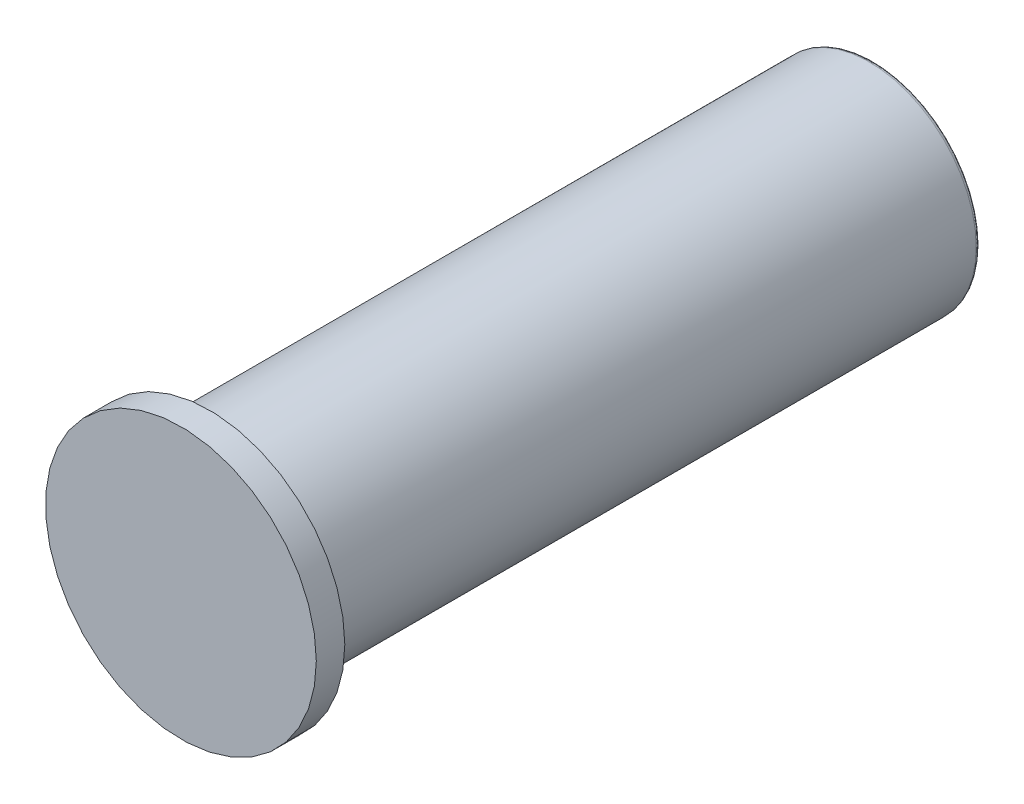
SolidWorks part; units mm, degrees
ref_plane "Front Plane" through (0, 0, 0) normal (0, 0, 1) x (1, 0, 0)
ref_plane "Top Plane" through (0, 0, 0) normal (0, 1, 0) x (1, 0, 0)
ref_plane "Right Plane" through (0, 0, 0) normal (1, 0, 0) x (0, 0, -1)
sketch "Sketch1" plane through (0, 0, 0) normal (1, 0, 0) x (0, 0, -1)
  line L0 (0, 0) -> (208, 0) construction
  line L1 (208, 0) -> (208, 36)
  line L2 (206.5, 37.5) -> (10, 37.5)
  line L3 (10, 37.5) -> (10, 47.5)
  line L4 (10, 47.5) -> (0, 47.5)
  line L5 (0, 47.5) -> (0, 0)
  line L6 (0, 0) -> (208, 0)
  arc A0 (208, 36) -> (206.5, 37.5) centre (206.5, 36) ccw
  point P9 (208, 37.5)
  dimension "D5" = 1.5
  dimension "D1" = 10
  dimension "D2" = 198
  dimension "D3" = 75
  dimension "D4" = 95
revolve "Revolve1" add sketch "Sketch1" angle 360 about L0
hole_wizard "M8x1.0 Tapped Hole1" positions "Sketch3" profile "Sketch2" tap size "M8x1.0" standard "AS"
sketch "Sketch3" plane through (0, 0, -208) normal (0, 0, -1) x (-1, 0, 0)
  point P0 (0, 0)
sketch "Sketch2" plane through (0, 0, -208) normal (1, 0, 0) x (0, 1, 0)
  line L0 (0, 0) -> (0, 10.103)
  line L1 (0, 10.103) -> (3.5, 8)
  line L2 (3.5, 8) -> (3.5, 0.525)
  line L3 (3.5, 0.525) -> (4.025, 0)
  line L5 (4.025, 0) -> (0, 0)
  line L6 (-3.5, 0.525) -> (-4.025, 0) construction
  line L10 (0, 10.103) -> (-3.5, 8) construction
  line L11 (0, -6.35) -> (0, 107.95) construction
  dimension "Tap Drill Dia." = 7
  dimension "Tap Drill Depth" = 8
  dimension "Near C'Sink Dia." = 8.05
  dimension "Near C'Sink Angle" = 90
  dimension "Drill Angle" = 118
